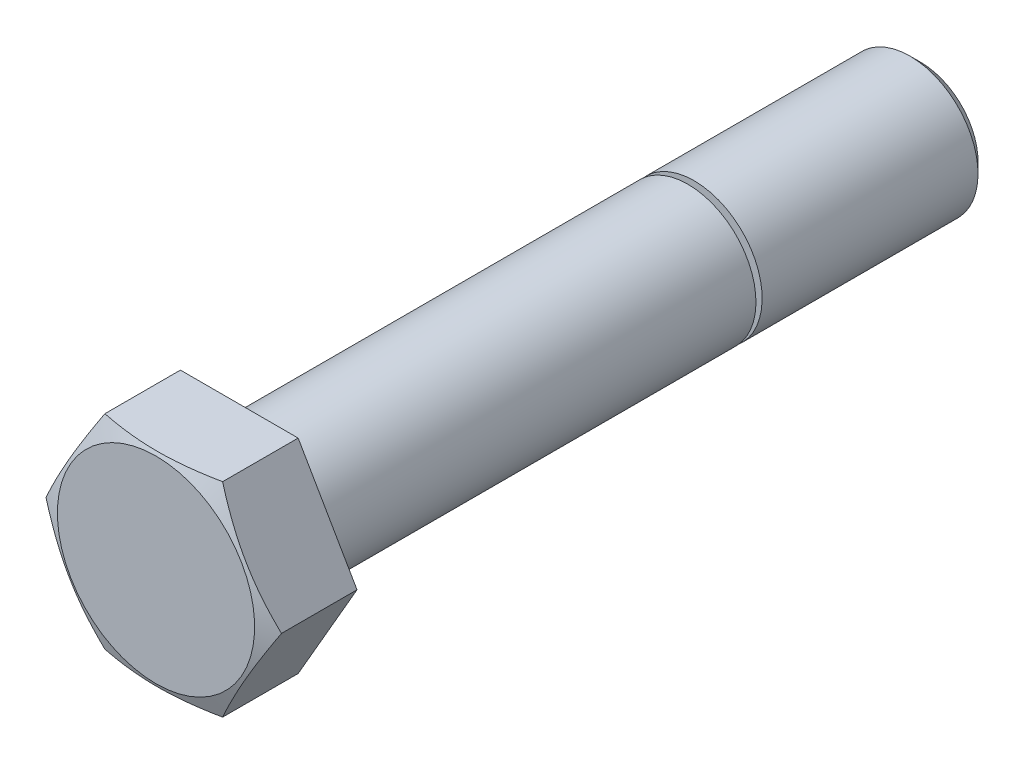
SolidWorks part; units mm, degrees
ref_plane "Front Plane" through (0, 0, 0) normal (0, 0, 1) x (1, 0, 0)
ref_plane "Top Plane" through (0, 0, 0) normal (0, 1, 0) x (1, 0, 0)
ref_plane "Right Plane" through (0, 0, 0) normal (1, 0, 0) x (0, 0, -1)
imported_body "vite_iso_4014-m12x70-8_8"
other "Sposta faccia1" parameters "D1"=10
